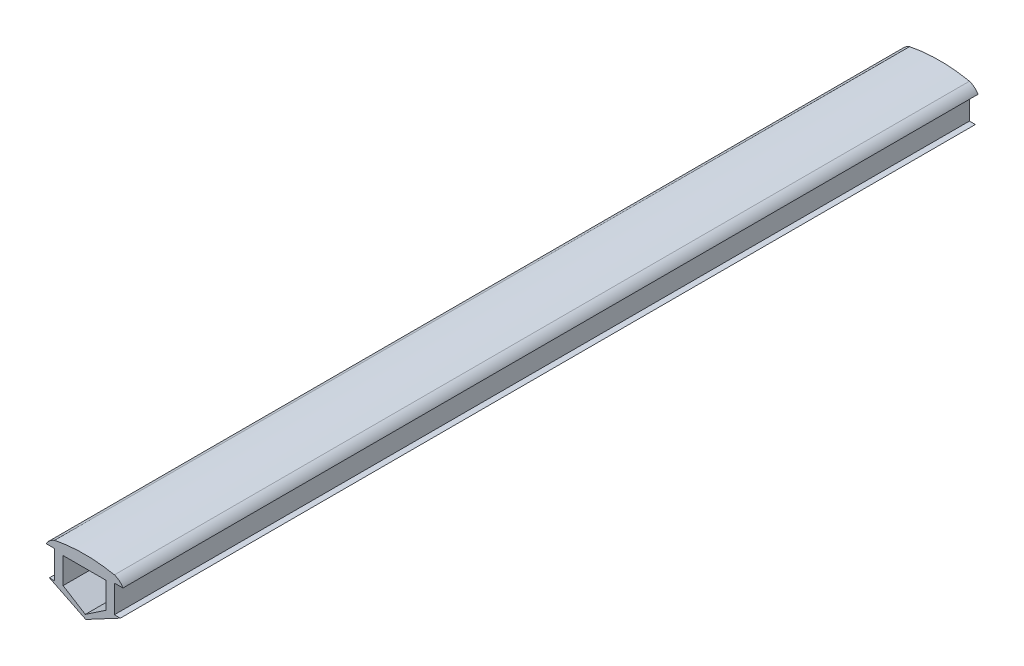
SolidWorks part; units mm, degrees
ref_plane "前视基准面" through (0, 0, 0) normal (0, 0, 1) x (1, 0, 0)
ref_plane "上视基准面" through (0, 0, 0) normal (0, 1, 0) x (1, 0, 0)
ref_plane "右视基准面" through (0, 0, 0) normal (1, 0, 0) x (0, 0, -1)
sketch "草图1" plane through (0, 0, 0) normal (0, 0, 1) x (1, 0, 0)
  line L0 (-73.0526, -2.195) -> (-65.5526, -2.195)
  line L1 (-65.5526, -2.195) -> (-65.5526, -6.7721)
  line L2 (-65.5526, -6.7721) -> (-69.1535, -9.195)
  line L3 (-69.1535, -9.195) -> (-73.0526, -6.7721)
  line L4 (-73.0526, -6.7721) -> (-73.0526, -2.195)
  line L5 (-74.5526, -2.7854) -> (-74.5526, -6.7854)
  line L6 (-74.5526, -6.7854) -> (-75.4575, -6.7854)
  line L7 (-75.4575, -6.7854) -> (-69.0717, -9.9189)
  line L8 (-69.1535, -9.195) -> (-69.1535, 55.8969) construction
  line L9 (-69.0717, -9.9189) -> (-63.0134, -6.695)
  line L10 (-63.0134, -6.695) -> (-64.0526, -6.695)
  line L11 (-64.0526, -6.695) -> (-64.0526, -2.695)
  line L13 (-74.5526, -2.7854) -> (-74.5526, -1.8814)
  line L14 (-74.5526, -1.8814) -> (-76.0526, -1.8814)
  line L15 (-64.0526, -2.695) -> (-64.0526, -1.8814)
  line L16 (-64.0526, -1.8814) -> (-62.5526, -1.8814)
  arc A0 (-74.5526, -0.6333) -> (-64.0526, -0.6333) centre (-69.3026, -26.5374) cw
  arc A1 (-76.0526, -1.8814) -> (-74.5526, -0.6333) centre (-73.4205, -3.5194) cw
  arc A2 (-64.0526, -0.6333) -> (-62.5526, -1.8814) centre (-64.8813, -3.1548) cw
  dimension "D1" = 1.5
  dimension "D2" = 1.5
  dimension "D3" = 7.5
  dimension "D5" = 4
  dimension "D6" = 4
  dimension "D7" = 0.0904
  dimension "D8" = 4.5
  dimension "D10" = 1.5
  dimension "D11" = 1.5
extrude "拉伸1" add sketch "草图1" along normal blind 150
